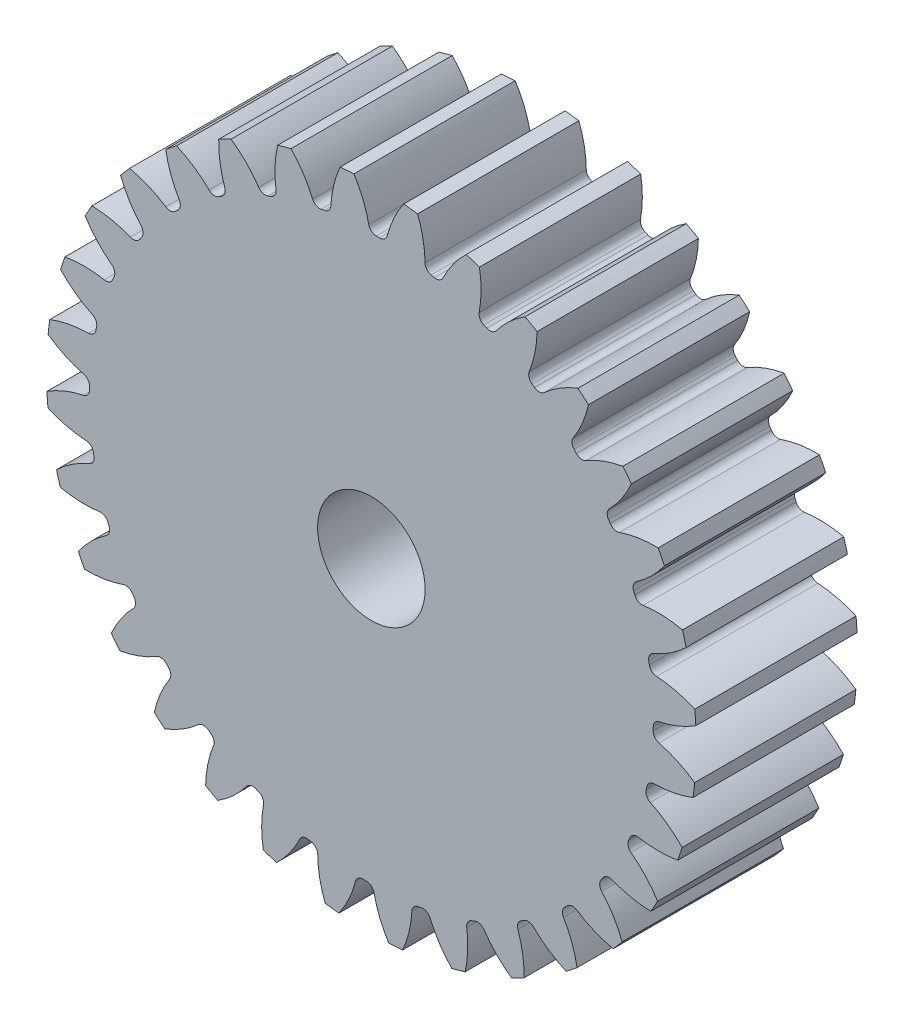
SolidWorks part; units mm, degrees
ref_plane "Front" through (0, 0, 0) normal (0, 0, 1) x (1, 0, 0)
ref_plane "Top" through (0, 0, 0) normal (0, 1, 0) x (1, 0, 0)
ref_plane "Right" through (0, 0, 0) normal (1, 0, 0) x (0, 0, -1)
sketch "Sketch3" plane through (0, 0, 0) normal (0, 0, 1) x (1, 0, 0)
  circle A0 centre (0, 0) radius 191.9111
  dimension "od" = 383.8222
extrude "gearBody" add sketch "Sketch3" along normal blind 95.25
sketch "Sketch2" plane through (0, 0, 0) normal (0, 0, 1) x (1, 0, 0)
  line L0 (0, 0) -> (156.8095, 64.9526) construction
  line L1 (191.2215, -19.3396) -> (0, 0) construction
  line L2 (0, 0) -> (36.3143, 0) construction
  line L3 (180.5621, 4.6584) -> (180.1537, -13.0013) construction
  line L5 (180.3579, -4.1714) -> (0, 0) construction
  line L7 (0, 0) -> (169.7294, 0) construction
  arc A0 (169.7232, 1.4482) -> (169.4748, -9.2933) centre (0, 0) ccw construction
  arc A1 (191.6345, 10.301) -> (190.9533, -19.1497) centre (0, 0) ccw construction
  arc A2 (180.5621, 4.6584) -> (180.1537, -13.0013) centre (0, 0) ccw construction
  arc A3 (166.4414, -4.8167) -> (166.4861, -2.8834) centre (0, 0) ccw
  arc A4 (191.2215, -19.3396) -> (169.8824, -9.3975) centre (153.6389, -72.1328) ccw
  arc A5 (191.2215, -19.3396) -> (191.9111, 10.4783) centre (0, 0) ccw
  arc A6 (191.9111, 10.4783) -> (170.1352, 1.5334) centre (156.8095, 64.9526) cw
  arc A7 (166.4861, -2.8834) -> (170.1352, 1.5334) centre (171.08, -2.963) cw
  arc A8 (169.8824, -9.3975) -> (166.4414, -4.8167) centre (171.0341, -4.9496) cw
  point P6 (191.9111, 10.4783)
  point P22 (191.2215, -19.3396)
  dimension "baseDia" = 339.4587
  dimension "od" = 383.8222
  dimension "pd" = 361.2444
  dimension "rd" = 333.0222
  dimension "rFillet" = 4.5946
  dimension "pointX" = 191.9111
  dimension "pointY" = 10.4783
  dimension "CTT" = 17.6597
  dimension "flankCenterAngle" = 22.5
extrude "toothCut" cut sketch "Sketch2" along normal through all
pattern_circular "CirPattern1" count 32 over 360 about axis through (0, 0, 0) along (0, 0, 1) of "toothCut"
sketch "hub1Dia" plane through (0, 0, 0) normal (0, 0, -1) x (-1, 0, 0)
  circle A0 centre (0, 0) radius 12.7
  dimension "hub1Dia" = 25.4
sketch "hub2Dia" plane through (0, 0, 95.25) normal (0, 0, 1) x (1, 0, 0)
  circle A0 centre (0, 0) radius 12.7
  dimension "hub2dia" = 25.4
sketch "boreDia" plane through (0, 0, 0) normal (0, 0, 1) x (1, 0, 0)
  circle A0 centre (0, 0) radius 31.75
  dimension "boreDia" = 63.5
extrude "bore" cut sketch "boreDia" against normal mid plane 25400
